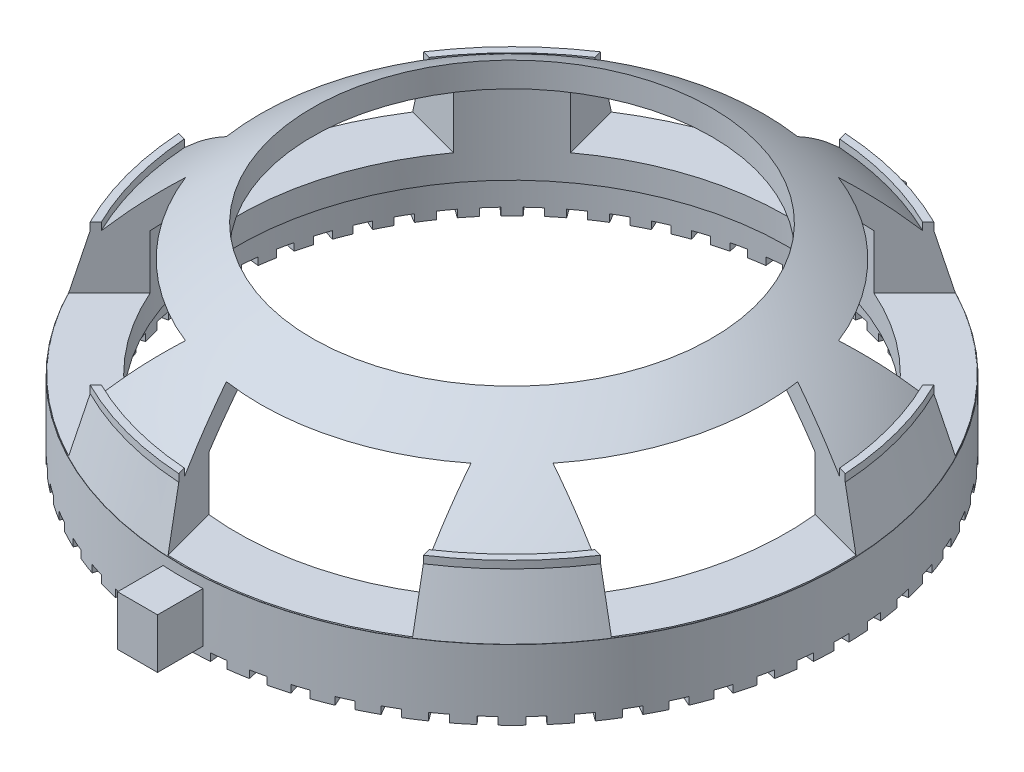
SolidWorks part; units mm, degrees
ref_plane "Front Plane" through (0, 0, 0) normal (0, 0, 1) x (1, 0, 0)
ref_plane "Top Plane" through (0, 0, 0) normal (0, 1, 0) x (1, 0, 0)
ref_plane "Right Plane" through (0, 0, 0) normal (1, 0, 0) x (0, 0, -1)
sketch "Sketch1" plane through (0, 0, 0) normal (0, 0, 1) x (1, 0, 0)
  line L0 (0, 0) -> (0, 2.0474) construction
  line L5 (5.9, 0) -> (6.6, 0)
  line L6 (5.9, 0) -> (5.9, 0.9)
  line L8 (6.6, 0) -> (6.6, 1.4)
  line L9 (5.9, 0.9) -> (5.5, 0.9)
  line L11 (6.15, 2.5) -> (5.5, 2.5) construction
  line L12 (5.5, 0.9) -> (5.5, 2.5)
  line L13 (4, 4.0441) -> (4, 3.5452)
  line L15 (6.5947, 1.3416) -> (6.5947, 1.4) construction
  line L16 (6.5947, 1.4) -> (6.6, 1.4)
  line L18 (4, 3.5452) -> (4, 2.2737) construction
  line L19 (4, 6.5703) -> (4, 4.0441) construction
  line L20 (0, 0) -> (7.9395, 0) construction
  line L21 (6.5947, 1.4) -> (6.3, 2.5)
  line L22 (6.3, 2.5) -> (6.15, 2.5) construction
  line L23 (6.15, 2.5) -> (6.5947, 1.3416) construction
  line L24 (6.15, 2.5) -> (6.15, 2.65)
  line L25 (6.15, 2.65) -> (6.3, 2.65)
  line L26 (6.3, 2.65) -> (6.3, 2.5)
  line L27 (0, 5.0058) -> (6.9836, 5.0058) construction
  arc A0 (6.15, 2.5) -> (4, 4.0441) centre (0, -3.7942) ccw
  arc A1 (6.6, 1.3348) -> (6.5488, 1.4) centre (0, -3.7942) ccw construction
  arc A2 (4, 4.0441) -> (6.15, 2.5) centre (0, -3.7942) ccw construction
  arc A3 (4, 3.5452) -> (6.6, 1.3348) centre (0, -3.7942) ccw construction
  arc A4 (6.5947, 1.3416) -> (5.5, 2.5) centre (0, -3.7942) ccw construction
  arc A5 (5.5, 2.5) -> (4, 3.5452) centre (0, -3.7942) ccw
  arc A6 (6.5488, 1.4) -> (6.5947, 1.3416) centre (0, -3.7942) ccw construction
  point P20 (6.5974, 1.4)
  dimension "D9" = 17.6
  dimension "D10" = 4
  dimension "D2" = 0.7
  dimension "D3" = 5.9
  dimension "D4" = 0.65
  dimension "D5" = 0.5
  dimension "D6" = 2.5
  dimension "D7" = 1.1
  dimension "D8" = 5.5
  dimension "D11" = 105
  dimension "D12" = 0.15
  dimension "D13" = 0.15
revolve "Revolve2" add sketch "Sketch1" angle 360 about L0
ref_plane "Plane1" through (0, 0, -7.5) normal (0, 0, 1) x (1, 0, 0)
sketch "Sketch2" plane through (0, 0, -7.5) normal (0, 0, 1) x (1, 0, 0)
  line L0 (6.6, 1.4) -> (-6.6, 1.4) construction
  line L1 (-0.4, 0.2) -> (0.4, 0.2)
  line L2 (-0.4, 0.2) -> (-0.4, 1.2)
  line L3 (-0.4, 1.2) -> (0.4, 1.2)
  line L4 (0.4, 0.2) -> (0.4, 1.2)
  point P6 (0, 1.2)
  dimension "D1" = 1
  dimension "D2" = 0.8
  dimension "D3" = 0.2
extrude "Boss-Extrude1" add sketch "Sketch2" along normal up to surface (0.9121 mm away)
ref_plane "Plane2" through (0, 0, 7.5) normal (0, 0, 1) x (1, 0, 0)
sketch "Sketch3" plane through (0, 0, 7.5) normal (0, 0, 1) x (1, 0, 0)
  line L0 (6.6, 1.4) -> (-6.6, 1.4) construction
  line L1 (-0.4, 0.2) -> (0.4, 0.2)
  line L2 (-0.4, 0.2) -> (-0.4, 1.2)
  line L3 (-0.4, 1.2) -> (0.4, 1.2)
  line L4 (0.4, 0.2) -> (0.4, 1.2)
  point P6 (0, 1.2)
  dimension "D1" = 0.8
  dimension "D2" = 1
  dimension "D3" = 0.2
extrude "Boss-Extrude2" add sketch "Sketch3" against normal blind 1
sketch "Sketch5" plane through (0, 0, 7.5) normal (0, 0, 1) x (1, 0, 0)
  line L1 (-2, 3.41) -> (2, 3.41)
  line L2 (-2, 3.41) -> (-2, 1.41)
  line L3 (-2, 1.41) -> (2, 1.41)
  line L4 (2, 3.41) -> (2, 1.41)
  dimension "D1" = 4
  dimension "D2" = 2
  dimension "D3" = 2
  dimension "D4" = 1.41
extrude "Cut-Extrude1" [suppressed] cut sketch "Sketch5" against normal blind 16
pattern_circular "CirPattern3" [suppressed] count 3 every 60 about axis through (0, 0, 0) along (0, 1, 0)
chamfer "Chamfer1" [suppressed] distance 0.3 angle 45
sketch "Sketch6" plane through (0, 0, 0) normal (0, 0, 1) x (1, 0, 0)
  line L0 (0, 0) -> (0, 5.5817) construction
ref_plane "Plane3" through (0, 0, 0) normal (0.7071, 0, -0.7071) x (0, 1, 0)
sketch "Sketch7" plane through (0, 0, 0) normal (0.7071, 0, -0.7071) x (0, 1, 0)
  line L0 (0, 5.9) -> (0, -5.9) construction
  line L1 (1.42, 2) -> (3.42, 2)
  line L2 (1.42, 2) -> (1.42, -2)
  line L3 (1.42, -2) -> (3.42, -2)
  line L4 (3.42, 2) -> (3.42, -2)
  dimension "D1" = 1.42
  dimension "D2" = 4
  dimension "D3" = 2
  dimension "D4" = 2
extrude "Cut-Extrude2" cut sketch "Sketch7" against normal blind 10
pattern_circular "CirPattern4" count 6 over 360 about axis through (0, 0, 0) along (0, 1, 0) of "Cut-Extrude2"
chamfer "Chamfer3" [suppressed] distance 0.7 angle 30
sketch "Sketch8" plane through (0, 0, 0) normal (0, 0, 1) x (1, 0, 0)
  line L0 (-6.6, 0) -> (6.6, 0) construction
  line L1 (-0.15, 0.15) -> (0.15, 0.15)
  line L2 (-0.15, 0.15) -> (-0.15, -0.15)
  line L3 (-0.15, -0.15) -> (0.15, -0.15)
  line L4 (0.15, 0.15) -> (0.15, -0.15)
  line L5 (0, -0.2002) -> (0, -0.4684) construction
  dimension "D1" = 0.3
  dimension "D2" = 0.15
  dimension "D3" = 0.15
  dimension "D4" = 0.3
extrude "Cut-Extrude3" cut sketch "Sketch8" against normal blind 10
pattern_circular "CirPattern5" count 60 every 6 about axis through (0, 0, 0) along (0, 1, 0) of "Cut-Extrude3"
